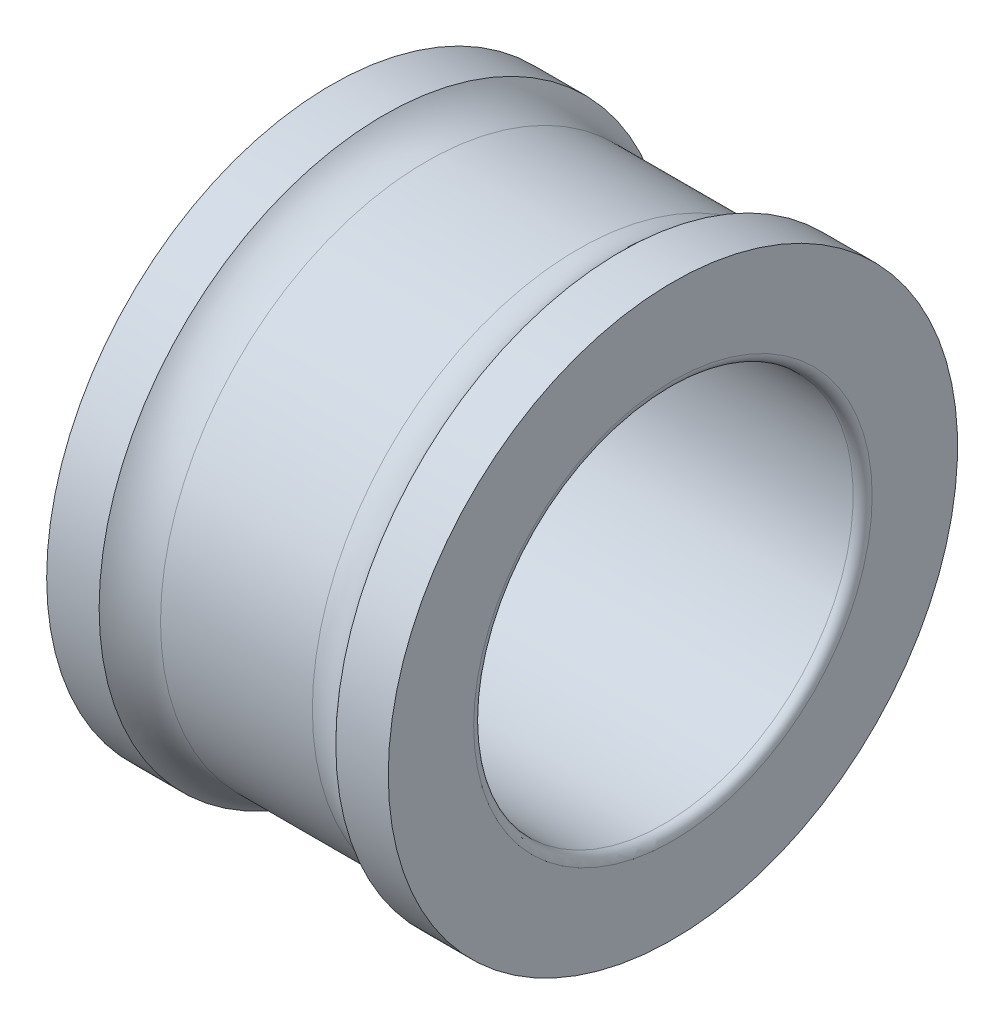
SolidWorks part; units mm, degrees
ref_plane "Plan de face" through (0, 0, 0) normal (0, 0, 1) x (1, 0, 0)
ref_plane "Plan de dessus" through (0, 0, 0) normal (0, 1, 0) x (1, 0, 0)
ref_plane "Plan de droite" through (0, 0, 0) normal (1, 0, 0) x (0, 0, -1)
sketch "Esquisse1" plane through (0, 0, 0) normal (0, 0, 1) x (1, 0, 0)
  line L0 (0, 10) -> (0, 15)
  line L1 (0, 15) -> (2.7639, 15)
  line L2 (5, 14) -> (13, 14)
  line L3 (15.2361, 15) -> (18, 15)
  line L4 (18, 15) -> (18, 10)
  line L5 (18, 10) -> (0, 10)
  line L6 (-2.3774, 0) -> (11.641, 0) construction
  arc A0 (2.7639, 15) -> (5, 14) centre (5, 17) ccw
  arc A1 (13, 14) -> (15.2361, 15) centre (13, 17) ccw
  dimension "D1" = 3
  dimension "D3" = 5
  dimension "D2" = 18
  dimension "D4" = 30
  dimension "D5" = 20
  dimension "D6" = 1
revolve "Révolution1" add sketch "Esquisse1" angle 360 about L6
fillet "Congé1" radius 0.5 2 edges at (0, 0, 10) (18, 0, 10)
